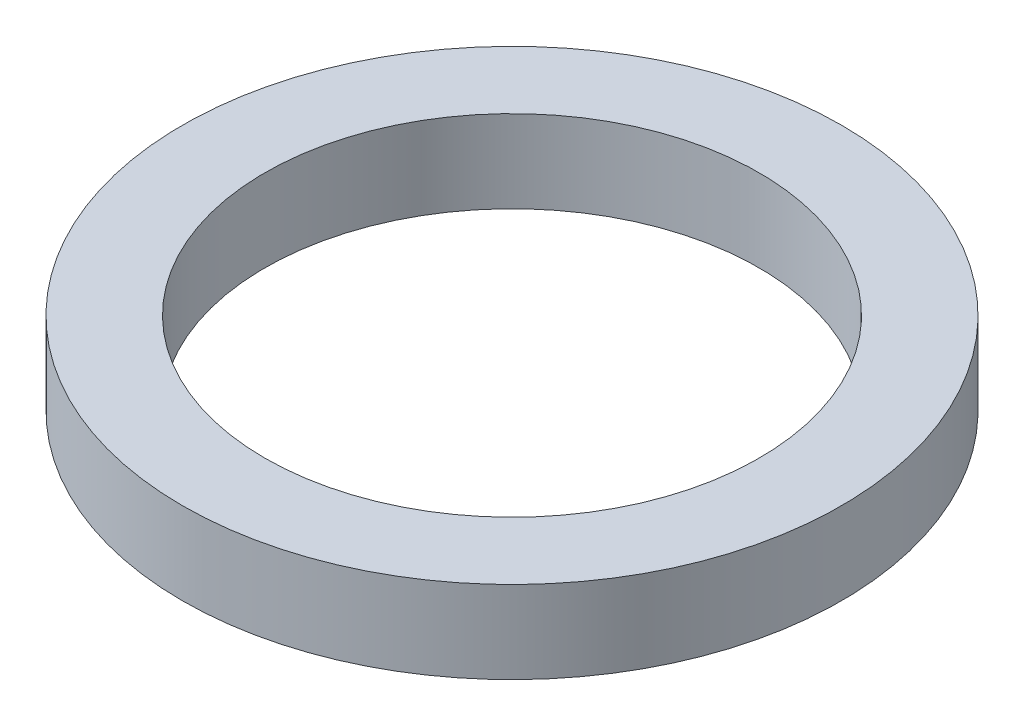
SolidWorks part; units mm, degrees
ref_plane "Front Plane" through (0, 0, 0) normal (0, 0, 1) x (1, 0, 0)
ref_plane "Top Plane" through (0, 0, 0) normal (0, 1, 0) x (1, 0, 0)
ref_plane "Right Plane" through (0, 0, 0) normal (1, 0, 0) x (0, 0, -1)
sketch "Sketch1" plane through (0, 0, 0) normal (0, 1, 0) x (1, 0, 0)
  circle A0 centre (0, 0) radius 8
  circle A1 centre (0, 0) radius 6
  dimension "D1" = 12
  dimension "D2" = 16
extrude "Boss-Extrude1" add sketch "Sketch1" along normal blind 2
